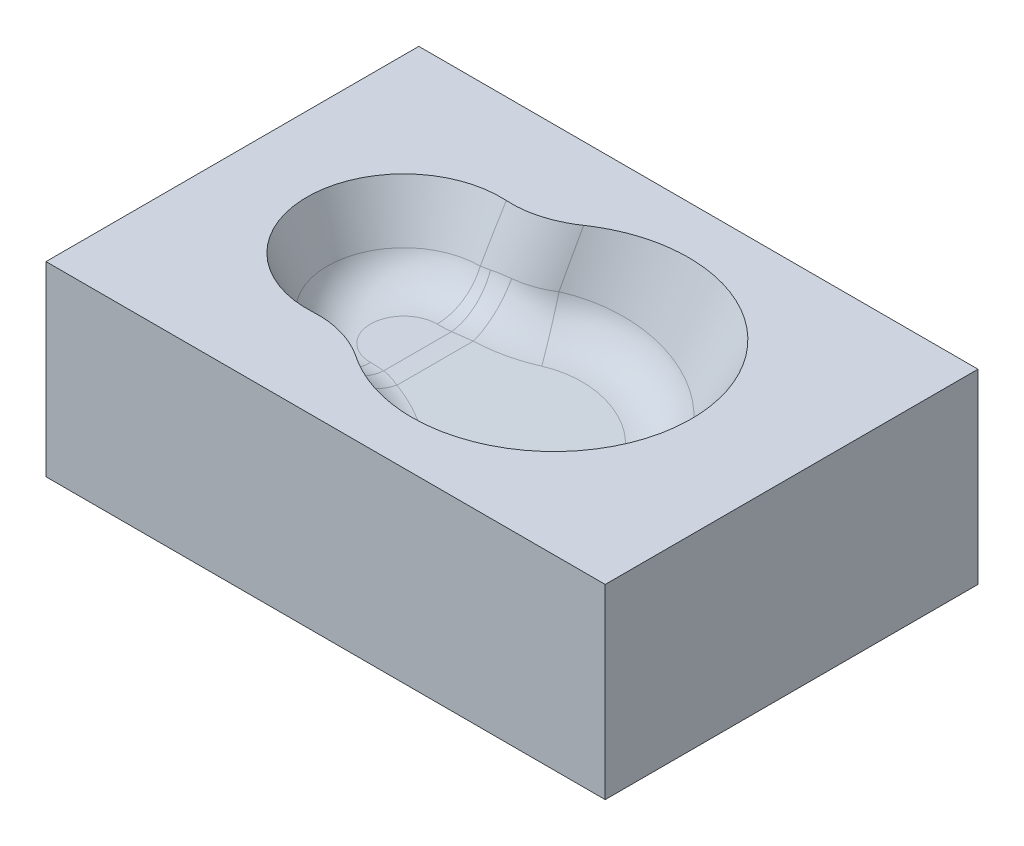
SolidWorks part; units mm, degrees
ref_plane "Front Plane" through (0, 0, 0) normal (0, 0, 1) x (1, 0, 0)
ref_plane "Top Plane" through (0, 0, 0) normal (0, 1, 0) x (1, 0, 0)
ref_plane "Right Plane" through (0, 0, 0) normal (1, 0, 0) x (0, 0, -1)
sketch "Sketch1" plane through (0, 0, 0) normal (0, 1, 0) x (1, 0, 0)
  line L1 (-152.4, -101.6) -> (152.4, -101.6)
  line L2 (-152.4, -101.6) -> (-152.4, 101.6)
  line L3 (-152.4, 101.6) -> (152.4, 101.6)
  line L4 (152.4, -101.6) -> (152.4, 101.6)
  line L5 (-152.4, -101.6) -> (152.4, 101.6) construction
  line L6 (-152.4, 101.6) -> (152.4, -101.6) construction
  point P0 (0, 0)
  dimension "D1" = 304.8
  dimension "D2" = 203.2
extrude "Boss-Extrude1" add sketch "Sketch1" along normal blind 152.4
sketch "Sketch2" plane through (0, 0, 0) normal (0, 0, 1) x (1, 0, 0)
  line L0 (-141.59, 173.5431) -> (-94.0828, 58.967)
  line L1 (-94.0828, 58.967) -> (-58.9958, 58.967)
  line L2 (-58.9958, 58.967) -> (-58.9958, 173.5431)
  line L3 (-58.9958, 173.5431) -> (-141.59, 173.5431)
revolve "Cut-Revolve1" cut sketch "Sketch2" angle 360 about L2
sketch "Sketch3" plane through (0, 0, 0) normal (0, 0, 1) x (1, 0, 0)
  line L0 (-2.1241, 5.3415) -> (30.302, 175.5616) construction
  line L1 (26.591, 156.0808) -> (117.7358, 138.7181)
  line L2 (117.7358, 138.7181) -> (63.5335, 37.9804)
  line L3 (63.5335, 37.9804) -> (6.1749, 48.9069)
  line L4 (26.591, 156.0808) -> (6.1749, 48.9069)
revolve "Cut-Revolve2" cut sketch "Sketch3" angle 360 about L0
sketch "Sketch4" plane through (0, 0, -101.6) normal (0, 0, -1) x (-1, 0, 0)
  line L0 (187.5446, 101.6) -> (-178.8505, 101.6)
  line L1 (-152.4, 152.4) -> (152.4, 152.4) construction
  dimension "D1" = 50.8
extrude "Cut-Extrude1" cut sketch "Sketch4" against normal through all both and the other way through all flip side to cut
fillet "Fillet13" radius 50.8 1 edges at (-46.6352, 58.967, 0)
fillet "Fillet14" radius 50.8 2 edges at (-42.5663, 58.9668, 31.0026)
fillet "Fillet16" radius 25.4 10 edges at (-50.5985, 59.722, -34.3896) (-50.5985, 59.722, 34.3896) (-94.0828, 58.967, 0) (63.5335, 37.9804, 0) (-27.0129, 70.6874, 51.4405) (-58.2724, 80.4088, -43.9715) (-43.5909, 58.3871, -38.3557) (-43.4266, 58.3558, 38.4097)
